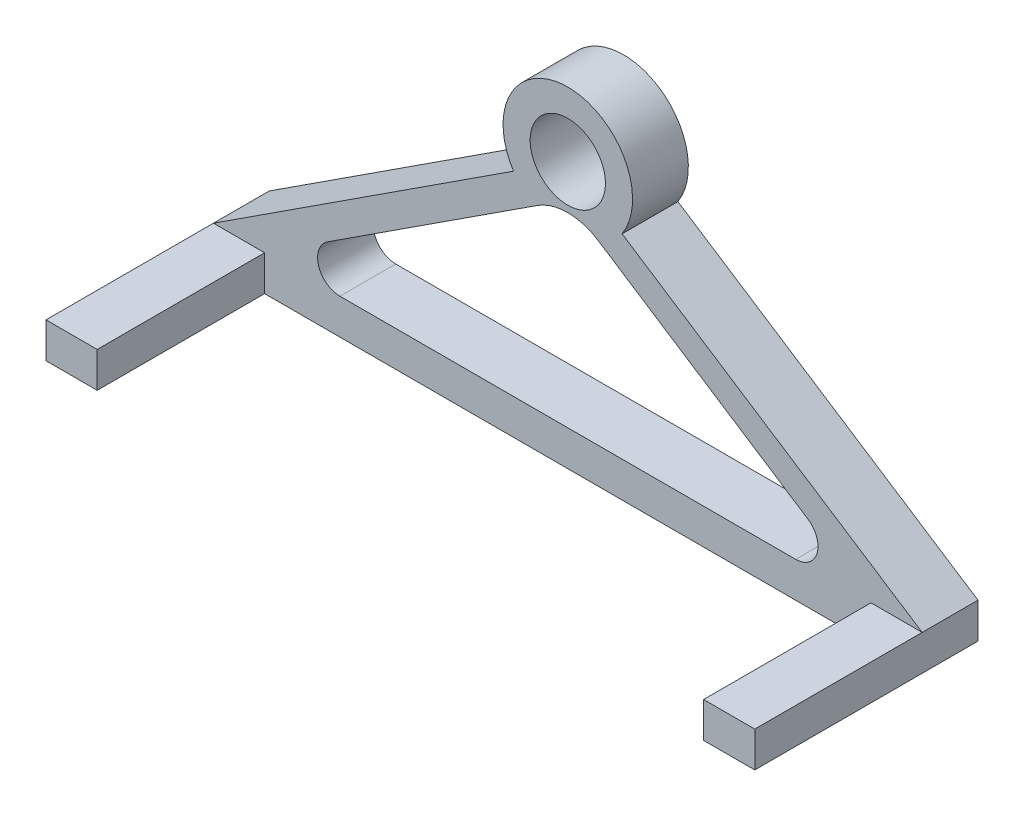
SolidWorks part; units mm, degrees
ref_plane "Alzado" through (0, 0, 0) normal (0, 0, 1) x (1, 0, 0)
ref_plane "Planta" through (0, 0, 0) normal (0, 1, 0) x (1, 0, 0)
ref_plane "Vista lateral" through (0, 0, 0) normal (1, 0, 0) x (0, 0, -1)
sketch "Croquis1" plane through (0, 0, 0) normal (0, 0, 1) x (1, 0, 0)
  line L0 (-63.5, 0) -> (63.5, 0)
  line L1 (-54.3263, 6.35) -> (54.3263, 6.35)
  line L2 (63.5, 6.35) -> (63.5, 0)
  line L3 (-63.5, 6.35) -> (-63.5, 0)
  line L4 (-9.7256, 41.3076) -> (-63.5, 6.35)
  line L5 (9.7256, 41.3076) -> (63.5, 6.35)
  line L6 (-5.4503, 38.1232) -> (-54.3263, 6.35)
  line L7 (5.4503, 38.1232) -> (54.3263, 6.35)
  line L8 (0, 41.6664) -> (-60.7748, 2.1579) construction
  line L9 (0, 41.6664) -> (60.7748, 2.1579) construction
  line L10 (0, 47.63) -> (63.5, 6.35) construction
  line L11 (0, 47.63) -> (-63.5, 6.35) construction
  arc A0 (5.4503, 38.1232) -> (-5.4503, 38.1232) centre (0, 29.7391) ccw
  arc A1 (9.7256, 41.3076) -> (-9.7256, 41.3076) centre (0, 47.63) ccw
  circle A2 centre (0, 47.63) radius 6.745
  dimension "D3" = 10
  dimension "D4" = 23.2
  dimension "D7" = 13.49
  dimension "D1" = 127
  dimension "D2" = 47.63
  dimension "D5" = 6.35
  dimension "D6" = 5
extrude "Extruir1" add sketch "Croquis1" along normal blind 10
sketch "Croquis2" plane through (0, 0, 10) normal (0, 0, 1) x (1, 0, 0)
  line L1 (-63.5, 0) -> (-54.3263, 0)
  line L2 (-63.5, 0) -> (-63.5, 6.35)
  line L3 (-63.5, 6.35) -> (-54.3263, 6.35)
  line L4 (-54.3263, 0) -> (-54.3263, 6.35)
extrude "Extruir2" add sketch "Croquis2" along normal blind 30
mirror "Simetría1" about plane through (0, 0, 0) normal (1, 0, 0) of "Extruir2"
fillet "Redondeo1" radius 4 2 edges at (54.3263, 6.35, 5) (-54.3263, 6.35, 5)
